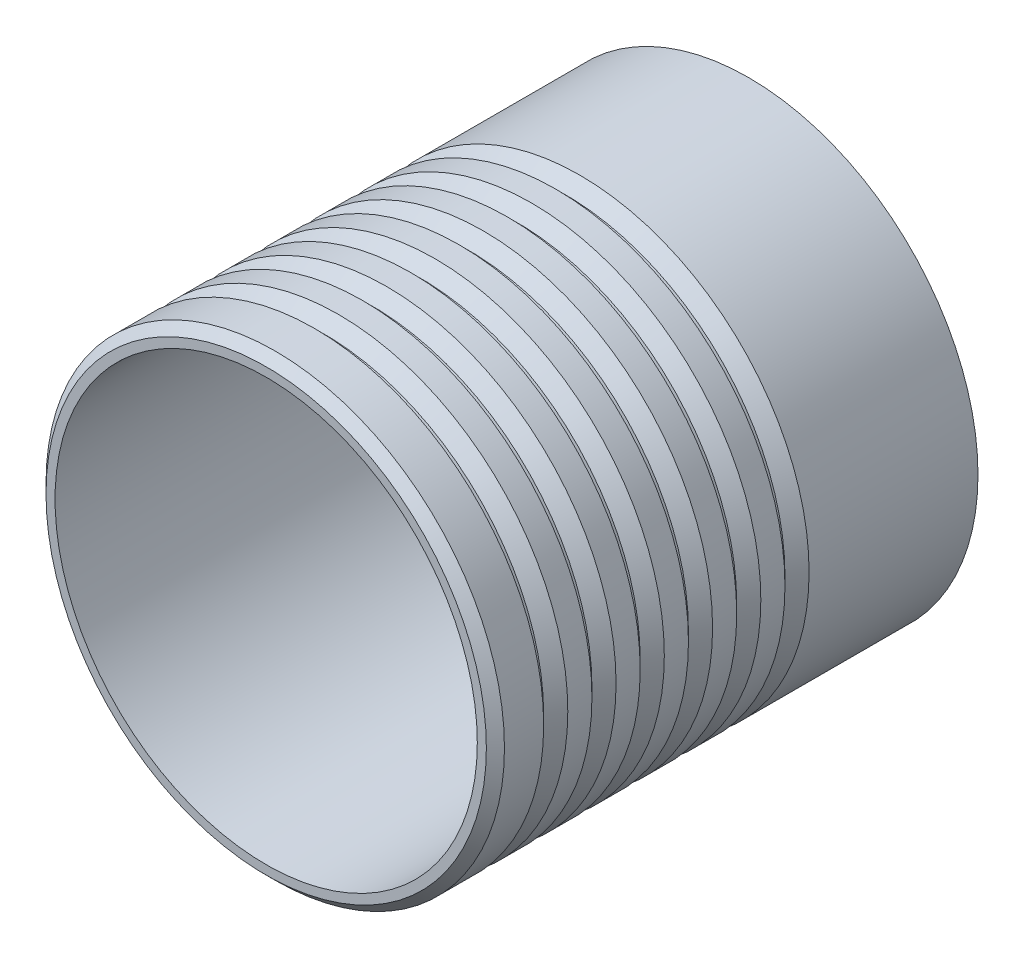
SolidWorks part; units mm, degrees
ref_plane "Plan de face" through (0, 0, 0) normal (0, 0, 1) x (1, 0, 0)
ref_plane "Plan de dessus" through (0, 0, 0) normal (0, 1, 0) x (1, 0, 0)
ref_plane "Plan de droite" through (0, 0, 0) normal (1, 0, 0) x (0, 0, -1)
sketch "Esquisse1" plane through (0, 0, 0) normal (0, 0, 1) x (1, 0, 0)
  circle A0 centre (0, 0) radius 35
  circle A1 centre (0, 0) radius 38
  dimension "D1" = 76
  dimension "D2" = 70
extrude "Extrusion1" add sketch "Esquisse1" along normal blind 80
sketch "Esquisse2" plane through (0, 0, 0) normal (1, 0, 0) x (0, 0, -1)
  line L0 (-72, 38) -> (-68, 38)
  line L1 (-68, 38) -> (-70.5, 36.5)
  line L2 (-70.5, 36.5) -> (-72, 36.5)
  line L3 (-72, 36.5) -> (-72, 38)
  line L4 (-80, 38) -> (-80, -38) construction
  line L5 (0, 38) -> (-80, 38) construction
  dimension "D1" = 1.5
  dimension "D2" = 1.5
  dimension "D3" = 4
  dimension "D4" = 8
revolve "Enlèvement de matière-Révolution1" cut sketch "Esquisse2" angle 360 about axis through (0, 0, 80) along (0, 0, -1)
pattern_linear "Répétition linéaire1" count 6 spacing 8 along (0, 0, -1) of "Enlèvement de matière-Révolution1"
chamfer "Chanfrein1" distance 1.5 angle 45 1 edges at (38, 0, 80)
